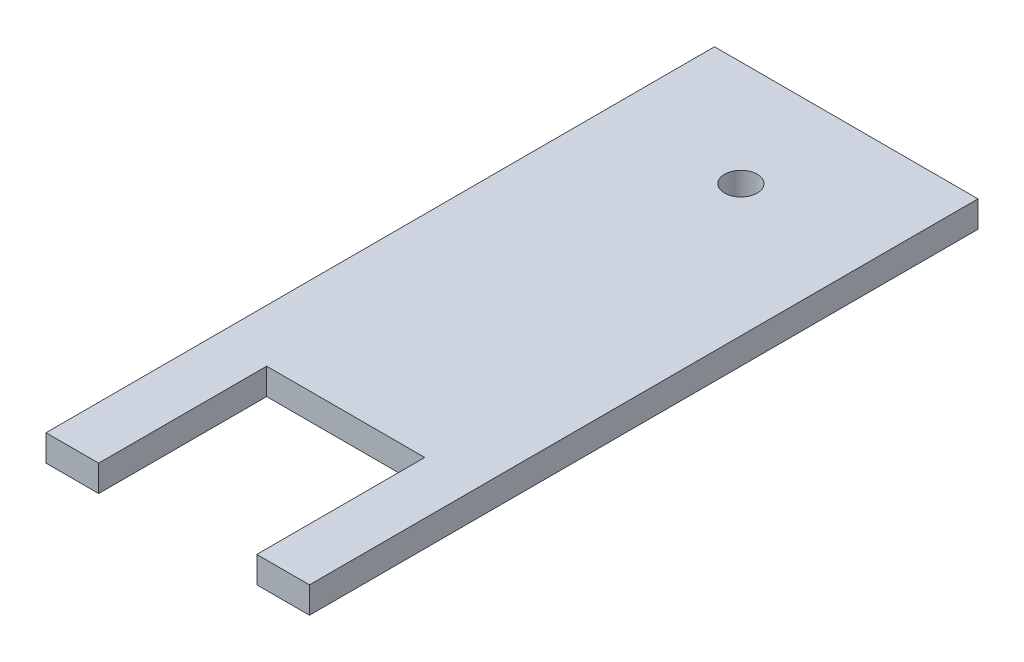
SolidWorks part; units mm, degrees
ref_plane "Front Plane" through (0, 0, 0) normal (0, 0, 1) x (1, 0, 0)
ref_plane "Top Plane" through (0, 0, 0) normal (0, 1, 0) x (1, 0, 0)
ref_plane "Right Plane" through (0, 0, 0) normal (1, 0, 0) x (0, 0, -1)
sketch "Sketch1" plane through (0, 0, 0) normal (0, 1, 0) x (1, 0, 0)
  line L0 (0, 0) -> (127, 0)
  line L1 (0, 0) -> (0, 241.3)
  line L2 (127, 0) -> (127, 241.3)
  line L3 (0, 241.3) -> (127, 241.3)
  line L4 (63.5, 241.3) -> (63.5, 0) construction
  line L5 (127, 0) -> (101.6, 0)
  line L6 (127, 0) -> (127, -80.9625)
  line L7 (101.6, 0) -> (101.6, -80.9625)
  line L8 (127, -80.9625) -> (101.6, -80.9625)
  line L9 (25.4, 0) -> (0, 0)
  line L10 (25.4, 0) -> (25.4, -80.9625)
  line L11 (0, 0) -> (0, -80.9625)
  line L12 (25.4, -80.9625) -> (0, -80.9625)
  circle A0 centre (63.5, 190.5) radius 7.874
  dimension "D3" = 15.748
  dimension "D4" = 50.8
  dimension "D1" = 127
  dimension "D2" = 241.3
  dimension "D5" = 76.2
  dimension "D6" = 25.4
  dimension "D7" = 80.9625
extrude "Boss-Extrude1" add sketch "Sketch1" along normal blind 12.7 contours L3 L4 A0 L0 L2 | L4 L3 L1 L0 A0 | L8 L6 L0 L7 | L12 L10 L0 L11
ref_plane "Plane1" through (63.5, 0, 0) normal (-1, 0, 0) x (0, 0, 1)
